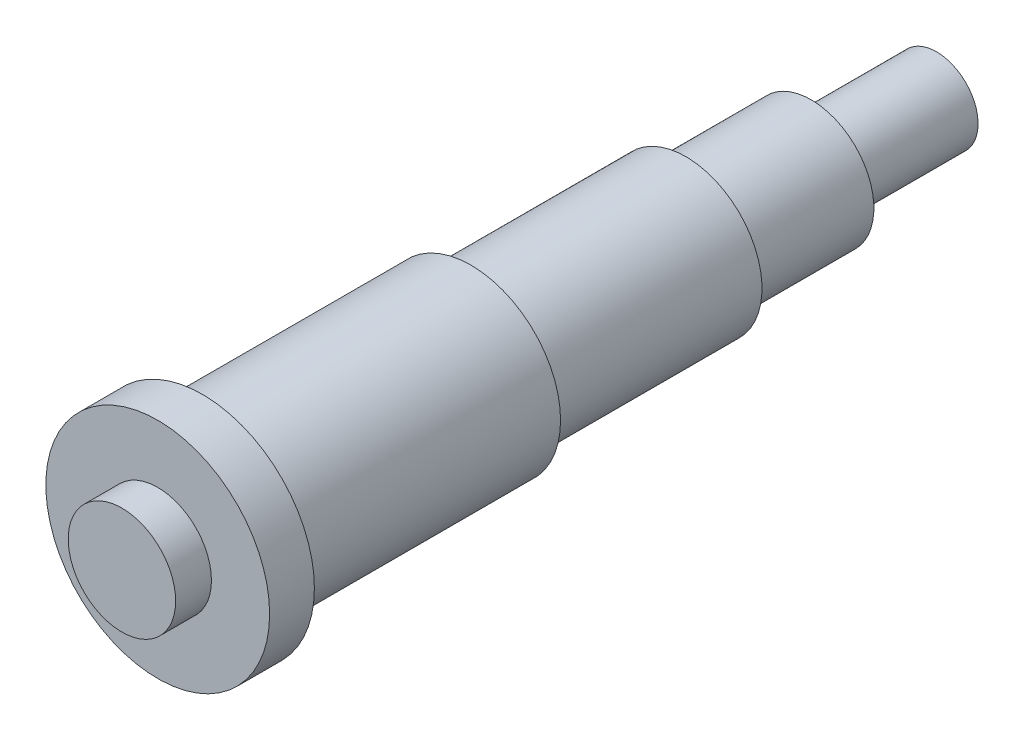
SolidWorks part; units mm, degrees
ref_plane "Front Plane" through (0, 0, 0) normal (0, 0, 1) x (1, 0, 0)
ref_plane "Top Plane" through (0, 0, 0) normal (0, 1, 0) x (1, 0, 0)
ref_plane "Right Plane" through (0, 0, 0) normal (1, 0, 0) x (0, 0, -1)
sketch "Sketch1" plane through (0, 0, 0) normal (0, 0, 1) x (1, 0, 0)
  circle A0 centre (0, 0) radius 12.5
  dimension "D1" = 25
extrude "Boss-Extrude1" add sketch "Sketch1" along normal blind 5
sketch "Sketch2" plane through (0, 0, 5) normal (0, 0, 1) x (1, 0, 0)
  circle A0 centre (0, 0) radius 6
  dimension "D1" = 12
extrude "Boss-Extrude2" add sketch "Sketch2" along normal blind 4
sketch "Sketch3" plane through (0, 0, 0) normal (0, 0, -1) x (-1, 0, 0)
  circle A0 centre (0, 0) radius 10
  dimension "D1" = 20
extrude "Boss-Extrude3" add sketch "Sketch3" along normal blind 30
sketch "Sketch4" plane through (0, 0, -30) normal (0, 0, -1) x (-1, 0, 0)
  circle A0 centre (0, 0) radius 8.5
  dimension "D1" = 17
extrude "Boss-Extrude4" add sketch "Sketch4" along normal blind 24
sketch "Sketch5" plane through (0, 0, -54) normal (0, 0, -1) x (-1, 0, 0)
  circle A0 centre (0, 0) radius 7
  dimension "D1" = 14
extrude "Boss-Extrude5" add sketch "Sketch5" along normal blind 14
sketch "Sketch6" plane through (0, 0, -68) normal (0, 0, -1) x (-1, 0, 0)
  circle A0 centre (0, 0) radius 4.6404
extrude "Boss-Extrude6" add sketch "Sketch6" along normal blind 14
